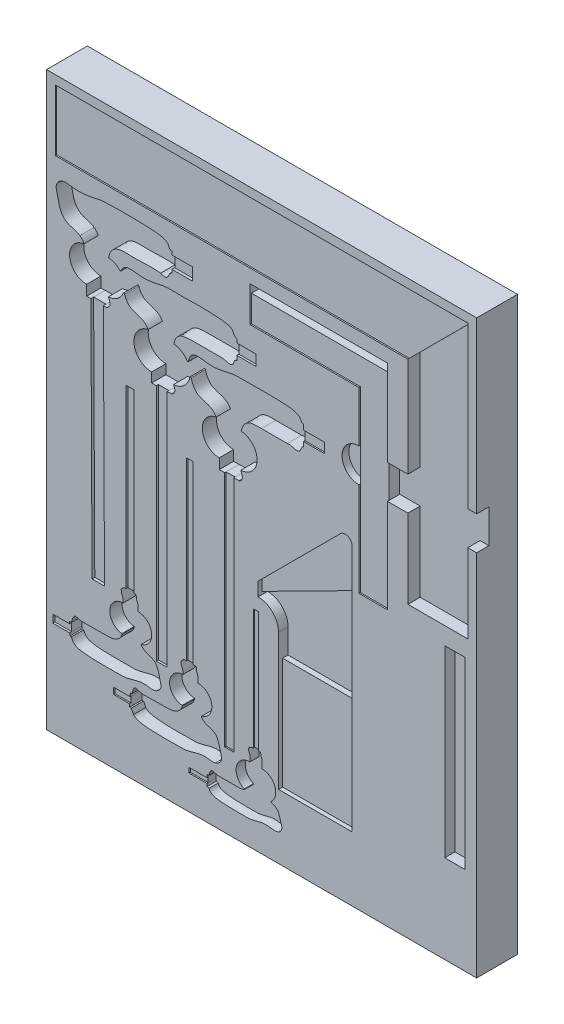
SolidWorks part; units mm, degrees
ref_plane "Front" through (0, 0, 0) normal (0, 0, 1) x (1, 0, 0)
ref_plane "Top" through (0, 0, 0) normal (0, 1, 0) x (1, 0, 0)
ref_plane "Right" through (0, 0, 0) normal (1, 0, 0) x (0, 0, -1)
sketch "Esquisse1" plane through (0, 0, 0) normal (0, 0, 1) x (1, 0, 0)
  line L1 (158, -210) -> (-158, -210)
  line L2 (158, -210) -> (158, 210)
  line L3 (158, 210) -> (-158, 210)
  line L4 (-158, -210) -> (-158, 210)
  line L5 (158, -210) -> (-158, 210) construction
  line L6 (158, 210) -> (-158, -210) construction
  point P0 (0, 0)
  dimension "D1" = 316
  dimension "D2" = 420
extrude "Boss.-Extru.1" add sketch "Esquisse1" along normal blind 30
other "Empreinte1"
other "faacom-allen-8<1>@insert-2-assemblage1"
other "Empreinte2"
other "faacom-allen-3<1>@insert-2-assemblage1"
other "faacom-allen-4<1>@insert-2-assemblage1"
other "faacom-allen-5<1>@insert-2-assemblage1"
other "faacom-allen-6<1>@insert-2-assemblage1"
other "faacom-allen-7<1>@insert-2-assemblage1"
other "Empreinte3"
other "petite-equerre<1>@insert-2-assemblage1"
other "grande-equerre<1>@insert-2-assemblage1"
other "Empreinte4"
other "module-allen-facom<1>@insert-2-assemblage1"
sketch "Esquisse2" plane through (0, 0, 30) normal (0, 0, 1) x (1, 0, 0)
  line L1 (149.5859, -145.2474) -> (134.5859, -145.2474)
  line L2 (149.5859, -145.2474) -> (149.5859, -10.2474)
  line L3 (149.5859, -10.2474) -> (134.5859, -10.2474)
  line L4 (134.5859, -145.2474) -> (134.5859, -10.2474)
  line L5 (149.5859, -145.2474) -> (134.5859, -10.2474) construction
  line L6 (149.5859, -10.2474) -> (134.5859, -145.2474) construction
  point P0 (142.0859, -77.7474)
  point P5 (135.8992, -99.5942)
  point P6 (142.0859, -77.7474)
  dimension "D1" = 135
  dimension "D2" = 15
extrude "Enlèv. mat.-Extru.1" cut sketch "Esquisse2" against normal blind 7.5
sketch "Esquisse3" plane through (0, 0, 30) normal (0, 0, 1) x (1, 0, 0)
  line L0 (107.5, 2.5) -> (107.5, 158.5) construction
  line L1 (107.5, 85.3043) -> (92.5, 85.3043)
  line L2 (107.5, 85.3043) -> (107.5, 60.5503)
  line L3 (107.5, 60.5503) -> (92.5, 60.5503)
  line L4 (92.5, 85.3043) -> (92.5, 60.5503)
  line L5 (92.5, -8.5) -> (92.5, 142) construction
extrude "Enlèv. mat.-Extru.2" cut sketch "Esquisse3" against normal up to surface (9 mm away)
sketch "Esquisse4" plane through (0, 0, 30) normal (0, 0, 1) x (1, 0, 0)
  line L0 (151.5, 203.5) -> (151.5, 2.5) construction
  line L1 (151.5, 85.3043) -> (158, 85.3043)
  line L2 (151.5, 85.3043) -> (151.5, 60.5503)
  line L3 (151.5, 60.5503) -> (158, 60.5503)
  line L4 (158, 85.3043) -> (158, 60.5503)
  line L5 (158, -210) -> (158, 210) construction
  line L6 (107.5, 85.3043) -> (92.5, 85.3043) construction
  line L7 (92.5, 60.5503) -> (107.5, 60.5503) construction
extrude "Enlèv. mat.-Extru.3" cut sketch "Esquisse4" against normal up to surface (9 mm away)
sketch "Esquisse5" plane through (0, 0, 30) normal (0, 0, 1) x (1, 0, 0)
  line L0 (71.5, -8.5) -> (71.5, 122.5) construction
  line L1 (107.5, 85.3043) -> (92.5, 85.3043) construction
  line L2 (92.5, 60.5503) -> (107.5, 60.5503) construction
  line L3 (71.5, 85.3043) -> (71.5, 60.5503)
  arc A0 (71.5, 85.3043) -> (71.5, 60.5503) centre (71.5, 72.9273) ccw
extrude "Enlèv. mat.-Extru.4" cut sketch "Esquisse5" against normal blind 5
sketch "Esquisse7" plane through (0, 0, 30) normal (0, 0, 1) x (1, 0, 0)
  line L0 (-80.7858, 69.6746) -> (-80.7858, 49.217) construction
  line L1 (-80.7858, 49.217) -> (-77.3546, 49.217) construction
  arc A0 (-73.1559, 79.7424) -> (-73.1559, 58.6915) centre (-80.7858, 69.217) ccw
  arc A1 (-73.1559, 58.6915) -> (-73.1559, 79.7424) centre (-65.526, 69.217) ccw
  spline S0 degree 3 poles (-66.5579, 49.6364) (-65.3755, 49.7065) (-63.7766, 51.2479) (-63.5681, 53.8699) (-64.806, 56.2429) (-65.4231, 59.0164) (-65.4586, 63.0545) (-65.54, 67.9658) (-65.5252, 73.1229) (-65.3802, 78.2916) (-64.466, 83.0924) (-62.7398, 87.6607) (-59.0402, 90.2048) (-54.8099, 90.904) (-48.8372, 91.1422) (-41.9051, 90.9735) (-35.4973, 91.0376) (-30.8546, 91.154) (-27.9522, 90.8783) (-25.5449, 90.4747) (-23.6331, 89.7296) (-20.7323, 90.4454) (-20.3605, 92.7989) (-19.8195, 93.7944) knots 0 0 0 0 0.039047 0.070102 0.084382 0.132296 0.167829 0.226062 0.304529 0.348962 0.40676 0.477042 0.511359 0.559058 0.624884 0.721626 0.801896 0.849793 0.88435 0.903947 0.935404 0.954917 1 1 1 1 construction
  point P10 (0, 0)
  dimension "D2" = 26
  dimension "D1" = 20
extrude "Enlèv. mat.-Extru.6" cut sketch "Esquisse7" against normal up to surface (10.5 mm away)
sketch "Esquisse8" plane through (0, 0, 30) normal (0, 0, 1) x (1, 0, 0)
  line L0 (-31.0942, 40.8632) -> (-31.0942, 18.9455) construction
  line L1 (-31.0942, 18.9455) -> (-27.111, 18.9455) construction
  arc A0 (-23.4452, 48.832) -> (-23.4452, 29.059) centre (-31.0942, 38.9455) ccw
  arc A1 (-23.4452, 29.059) -> (-23.4452, 48.832) centre (-15.7962, 38.9455) ccw
  spline S0 degree 3 poles (-15.8185, 34.4085) (-15.6221, 38.223) (-16.2542, 44.074) (-15.2659, 51.2751) (-13.6789, 55.7403) (-11.2716, 58.6027) (-6.7218, 60.8839) (-2.7832, 60.5092) (-0.1333, 60.5507) knots 0 0 0 0 0.312766 0.478191 0.591352 0.696911 0.775101 1 1 1 1 construction
  point P10 (0, 0)
  dimension "D2" = 25
  dimension "D1" = 20
extrude "Enlèv. mat.-Extru.7" cut sketch "Esquisse8" against normal up to surface (10.5 mm away)
fillet "Congé1" radius 0.5 4 edges at (-52.568, 70.2612, 24.75) (-53.4095, 73.9276, 24.75) (-101.2075, 97.1291, 24.75) (-103.5125, 108.4708, 24.75)
sketch "Esquisse9" plane through (0, 0, 30) normal (0, 0, 1) x (1, 0, 0)
  line L0 (-46.5298, -135.5155) -> (-46.5298, -125.5977) construction
  line L1 (-99.7473, -91.2213) -> (-101.3601, -91.2213) construction
  line L2 (-55.0808, -114.7686) -> (-56.931, -114.7686) construction
  arc A0 (-96.1407, -102.8127) -> (-96.1407, -119.6298) centre (-101.5533, -111.2213) ccw
  arc A1 (-96.1407, -119.6298) -> (-96.1407, -102.8127) centre (-90.7281, -111.2213) ccw
  arc A2 (-52.0529, -126.4323) -> (-52.0529, -143.105) centre (-57.5761, -134.7686) ccw
  arc A3 (-52.0529, -143.105) -> (-52.0529, -126.4323) centre (-46.5298, -134.7686) ccw
  spline S0 degree 3 poles (-103.4029, -93.4288) (-102.8661, -93.9564) (-103.274, -95.6) (-101.9239, -97.135) (-101.5957, -100.7394) (-101.7431, -105.9978) (-101.4286, -113.2189) (-101.6902, -119.4724) (-103.3367, -124.0043) (-105.6872, -126.2759) (-108.4019, -127.6263) (-112.1055, -128.0991) (-116.6674, -128.0187) (-121.819, -128.1942) (-126.1685, -128.178) (-129.7568, -128.1217) (-131.9253, -128.2848) (-133.5297, -128.0139) (-134.5275, -127.5833) (-135.6588, -127.5043) (-137.0976, -126.922) (-138.8673, -129.245) (-139.3957, -131.0081) (-139.6695, -132.5671) knots 0 0 0 0 0.028351 0.061877 0.077732 0.177303 0.282082 0.378695 0.436892 0.477373 0.511733 0.561612 0.630861 0.702248 0.776278 0.812091 0.851926 0.866315 0.879521 0.896532 0.914436 0.936716 1 1 1 1 construction
  spline S1 degree 3 poles (-74.1547, -141.7154) (-73.4855, -140.802) (-74.547, -137.8721) (-75.1728, -133.9766) (-76.265, -130.4084) (-77.5143, -127.9324) (-79.7934, -125.8721) (-83.7224, -124.8156) (-88.0249, -122.6986) (-90.2254, -118.3847) (-90.7752, -114.3506) (-90.7044, -110.5717) (-90.7765, -107.2649) (-90.7574, -104.1976) (-90.7665, -101.2825) (-90.7498, -99.013) (-90.8606, -97.3675) (-90.95, -95.6835) (-92.0584, -94.716) (-91.8987, -93.6666) knots 0 0 0 0 0.056741 0.152495 0.220657 0.255883 0.301297 0.381017 0.474191 0.548888 0.631271 0.692674 0.752836 0.809894 0.85827 0.91037 0.932112 0.947728 1 1 1 1 construction
  spline S2 degree 3 poles (-56.931, -114.7686) (-57.5934, -115.4182) (-59.2136, -116.2323) (-59.2661, -118.0134) (-59.0578, -119.2179) (-58.4997, -120.3644) (-57.7402, -121.8899) (-57.8638, -123.2089) (-57.7474, -124.4044) (-57.757, -125.499) (-57.7187, -127.5186) (-57.7125, -130.2688) (-57.6261, -133.345) (-57.5267, -136.2435) (-57.3905, -138.834) (-57.5395, -141.2829) (-57.8111, -143.813) (-58.4618, -146.1948) (-60.0735, -148.9921) (-62.8732, -150.9802) (-67.2187, -151.8692) (-72.0716, -151.9194) (-77.7605, -151.9324) (-82.8364, -151.9834) (-86.5881, -152.1944) (-89.0159, -151.7741) (-90.5722, -151.4148) (-91.712, -150.8172) (-92.6843, -150.758) (-93.8078, -151.4481) (-94.6181, -153.3147) (-95.0676, -154.8752) (-95.4013, -155.8041) knots 0 0 0 0 0.041719 0.056995 0.067757 0.090702 0.107653 0.134915 0.141748 0.155798 0.178638 0.222641 0.265843 0.301798 0.338742 0.369558 0.399857 0.44059 0.467229 0.527998 0.570154 0.643488 0.721731 0.797898 0.847011 0.871143 0.896379 0.910442 0.922365 0.933353 0.960884 1 1 1 1 construction
  point P30 (0, 0)
  dimension "D2" = 20
  dimension "D3" = 20
  dimension "D1" = 20
  dimension "D4" = 20
extrude "Enlèv. mat.-Extru.8" cut sketch "Esquisse9" against normal up to surface (9 mm away)
sketch "Esquisse10" plane through (0, 0, 30) normal (0, 0, 1) x (1, 0, 0)
  line L0 (-0.7519, -145.7723) -> (-2.2428, -145.7723) construction
  arc A0 (-4.1613, -156.8697) -> (-4.1613, -174.6749) centre (-8.7158, -165.7723) ccw
  arc A1 (-4.1613, -174.6749) -> (-4.1613, -156.8697) centre (0.3932, -165.7723) ccw
  spline S0 degree 3 poles (-6.0621, -145.7723) (-6.9772, -145.9731) (-9.0981, -146.059) (-9.7568, -148.4252) (-9.1565, -149.9002) (-8.4675, -151.2428) (-8.6396, -152.523) (-8.4849, -153.9899) (-8.5721, -155.9874) (-8.489, -158.6622) (-8.866, -161.4012) (-8.6984, -164.1483) (-8.7011, -166.8404) (-9.0614, -169.7303) (-9.7032, -172.8039) (-11.686, -175.2644) (-14.5234, -176.1003) (-17.522, -176.237) (-20.5029, -176.1268) (-23.2491, -176.3093) (-25.2511, -176.2125) (-27.2002, -176.2406) (-29.3749, -176.2505) (-31.8077, -176.2706) (-34.0171, -175.9432) (-35.4357, -175.1845) (-36.6766, -175.3468) (-38.3398, -176.5323) (-38.2327, -178.5136) (-38.8656, -179.4928) knots 0 0 0 0 0.052215 0.077275 0.104597 0.127835 0.147881 0.164899 0.198891 0.243779 0.293581 0.331208 0.375957 0.422906 0.471271 0.52596 0.56406 0.609941 0.67032 0.707431 0.742199 0.766657 0.801215 0.846864 0.883644 0.907872 0.921374 0.941822 1 1 1 1 construction
  spline S1 degree 3 poles (-38.6107, -187.5742) (-38.1279, -189.4621) (-34.6453, -191.3493) (-29.7946, -191.8264) (-25.1185, -192.0461) (-21.1443, -192.1701) (-17.4443, -192.2222) (-13.5639, -192.1939) (-9.7135, -192.3182) (-5.2157, -191.5909) (-1.5036, -190.3581) (2.1507, -189.7712) (5.3655, -189.9674) (8.2072, -190.4553) (10.971, -190.4365) (13.151, -189.6827) (14.3806, -188.1327) (15.2204, -185.9539) (14.007, -182.8702) (13.3042, -179.4811) (12.0644, -176.4897) (10.0892, -174.8113) (7.6052, -174.0581) (5.0812, -173.3325) (2.5144, -171.88) (1.0773, -169.2463) (0.3863, -166.5017) (0.2872, -163.7933) (0.4061, -160.8355) (0.3254, -157.3127) (0.2247, -154.1884) (0.3631, -151.1831) (0.301, -149.4078) (-0.2758, -148.3367) knots 0 0 0 0 0.052392 0.107505 0.143603 0.189895 0.224403 0.252344 0.304008 0.337268 0.385617 0.418864 0.44523 0.479904 0.503452 0.526173 0.544611 0.559971 0.592568 0.635826 0.664198 0.685191 0.709577 0.73964 0.762776 0.793904 0.824226 0.845716 0.873243 0.911265 0.949287 0.964921 1 1 1 1 construction
  point P8 (0, 0)
  dimension "D2" = 20
  dimension "D1" = 20
extrude "Enlèv. mat.-Extru.9" cut sketch "Esquisse10" against normal up to surface (6.7 mm away)
fillet "Congé2" radius 0.3 6 edges at (-44.3483, -144.5278, 25.5) (-88.7406, -121.0218, 25.5) (-102.4009, -121.1853, 25.5) (-58.0996, -144.7549, 25.5) (-12.1122, -175.1779, 26.65) (6.4646, -173.7182, 26.65)
